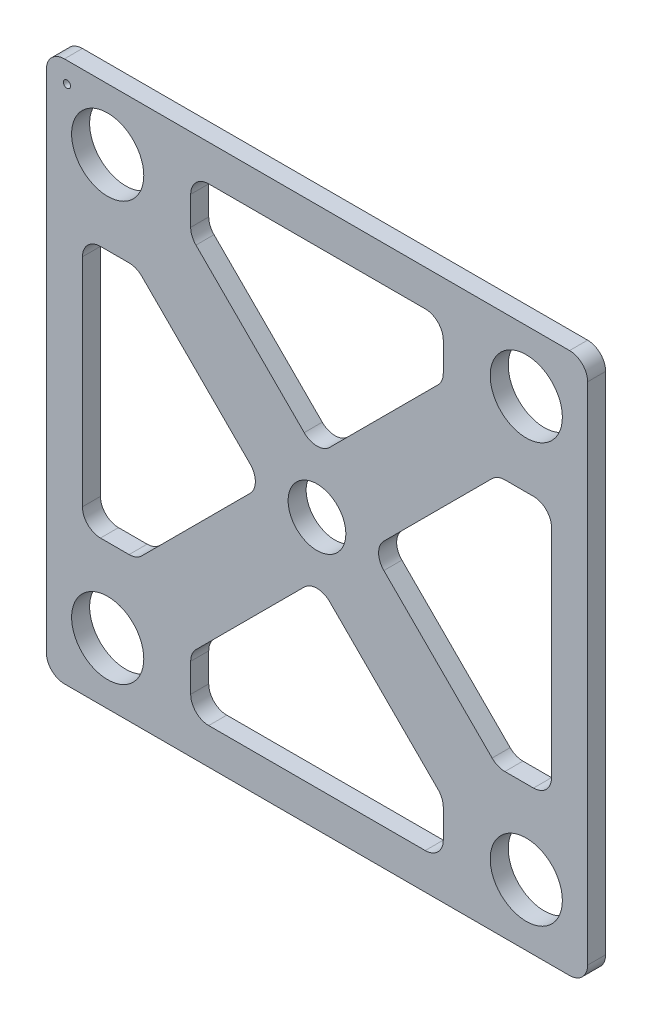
SolidWorks part; units mm, degrees
ref_plane "Plan de face" through (0, 0, 0) normal (0, 0, 1) x (1, 0, 0)
ref_plane "Plan de dessus" through (0, 0, 0) normal (0, 1, 0) x (1, 0, 0)
ref_plane "Plan de droite" through (0, 0, 0) normal (1, 0, 0) x (0, 0, -1)
sketch "Esquisse1" plane through (0, 0, 0) normal (0, 0, 1) x (1, 0, 0)
  line L0 (-30, 65) -> (30, 65)
  line L1 (-70, -75) -> (70, -75)
  line L2 (-75, -70) -> (-75, 70)
  line L3 (-70, 75) -> (70, 75)
  line L4 (75, -70) -> (75, 70)
  line L5 (-75, -75) -> (75, 75) construction
  line L6 (-75, 75) -> (75, -75) construction
  line L7 (35, 60) -> (35, 52.0711)
  line L8 (33.5355, 48.5355) -> (3.5355, 18.5355)
  line L9 (-35, 60) -> (-35, 52.0711)
  line L10 (-33.5355, 48.5355) -> (-3.5355, 18.5355)
  line L23 (-48.5355, 33.5355) -> (-18.5355, 3.5355)
  line L24 (-60, 35) -> (-52.0711, 35)
  line L25 (-65, 30) -> (-65, -30)
  line L26 (-60, -35) -> (-52.0711, -35)
  line L27 (-48.5355, -33.5355) -> (-18.5355, -3.5355)
  line L28 (48.5355, 33.5355) -> (18.5355, 3.5355)
  line L29 (60, 35) -> (52.0711, 35)
  line L30 (65, -30) -> (65, 30)
  line L31 (60, -35) -> (52.0711, -35)
  line L32 (48.5355, -33.5355) -> (18.5355, -3.5355)
  line L33 (33.5355, -48.5355) -> (3.5355, -18.5355)
  line L34 (35, -60) -> (35, -52.0711)
  line L35 (30, -65) -> (-30, -65)
  line L36 (-35, -60) -> (-35, -52.0711)
  line L37 (-33.5355, -48.5355) -> (-3.5355, -18.5355)
  circle A0 centre (-58, 58) radius 10
  circle A1 centre (58, 58) radius 10
  circle A2 centre (58, -58) radius 10
  circle A3 centre (-58, -58) radius 10
  arc A4 (35, 52.0711) -> (33.5355, 48.5355) centre (30, 52.0711) cw
  arc A5 (-35, -52.0711) -> (-33.5355, -48.5355) centre (-30, -52.0711) cw
  arc A6 (33.5355, -48.5355) -> (35, -52.0711) centre (30, -52.0711) cw
  arc A7 (3.5355, -18.5355) -> (-3.5355, -18.5355) centre (0, -22.0711) ccw
  arc A8 (-75, 70) -> (-70, 75) centre (-70, 70) cw
  arc A9 (-65, -30) -> (-60, -35) centre (-60, -30) ccw
  arc A10 (-52.0711, -35) -> (-48.5355, -33.5355) centre (-52.0711, -30) ccw
  arc A11 (-18.5355, 3.5355) -> (-18.5355, -3.5355) centre (-22.0711, 0) cw
  arc A12 (-48.5355, 33.5355) -> (-52.0711, 35) centre (-52.0711, 30) ccw
  arc A13 (-60, 35) -> (-65, 30) centre (-60, 30) ccw
  arc A14 (-30, 65) -> (-35, 60) centre (-30, 60) ccw
  arc A15 (-35, 52.0711) -> (-33.5355, 48.5355) centre (-30, 52.0711) ccw
  arc A16 (3.5355, 18.5355) -> (-3.5355, 18.5355) centre (0, 22.0711) cw
  arc A17 (18.5355, 3.5355) -> (18.5355, -3.5355) centre (22.0711, 0) ccw
  arc A18 (48.5355, 33.5355) -> (52.0711, 35) centre (52.0711, 30) cw
  arc A19 (60, 35) -> (65, 30) centre (60, 30) cw
  arc A20 (65, -30) -> (60, -35) centre (60, -30) cw
  arc A21 (52.0711, -35) -> (48.5355, -33.5355) centre (52.0711, -30) cw
  arc A22 (35, -60) -> (30, -65) centre (30, -60) cw
  arc A23 (-30, -65) -> (-35, -60) centre (-30, -60) cw
  arc A24 (-70, -75) -> (-75, -70) centre (-70, -70) cw
  arc A25 (70, -75) -> (75, -70) centre (70, -70) ccw
  arc A26 (70, 75) -> (75, 70) centre (70, 70) cw
  arc A27 (30, 65) -> (35, 60) centre (30, 60) cw
  circle A28 centre (0, 0) radius 8
  circle A29 centre (-69.2965, 69.2965) radius 1
  point P0 (0, 0)
  point P36 (35, 50)
  point P39 (-35, -50)
  point P42 (35, -50)
  point P45 (0, -15)
  point P51 (-65, -35)
  point P54 (-50, -35)
  point P57 (-15, 0)
  point P60 (-50, 35)
  point P63 (-65, 35)
  point P66 (-35, 65)
  point P69 (-35, 50)
  point P72 (0, 15)
  point P75 (15, 0)
  point P78 (50, 35)
  point P81 (65, 35)
  point P84 (65, -35)
  point P87 (50, -35)
  point P90 (35, -65)
  point P93 (-35, -65)
  point P105 (35, 65)
  dimension "D3" = 17
  dimension "D4" = 20
  dimension "D5" = 17
  dimension "D6" = 20
  dimension "D7" = 20
  dimension "D8" = 17
  dimension "D9" = 20
  dimension "D10" = 17
  dimension "D17" = 5
  dimension "D18" = 2
  dimension "D1" = 150
  dimension "D2" = 150
  dimension "D11" = 70
  dimension "D12" = 40
  dimension "D13" = 50
  dimension "D14" = 10
  dimension "D15" = 15
  dimension "D16" = 15
  dimension "D19" = 98
extrude "Boss.-Extru.1" add sketch "Esquisse1" along normal blind 5
